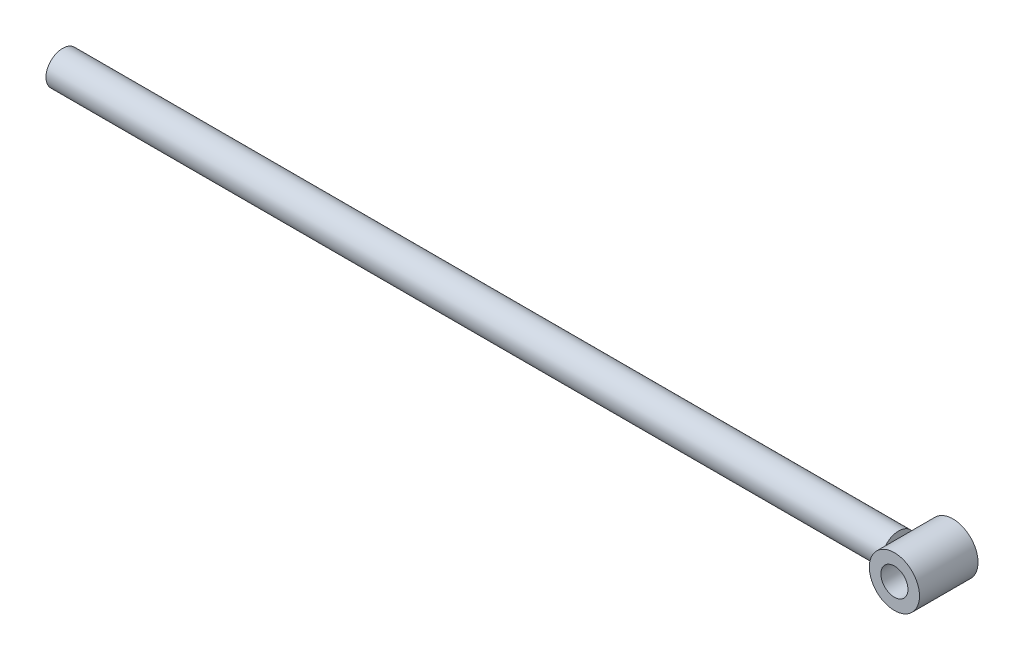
SolidWorks part; units mm, degrees
ref_plane "Plan de face" through (0, 0, 0) normal (0, 0, 1) x (1, 0, 0)
ref_plane "Plan de dessus" through (0, 0, 0) normal (0, 1, 0) x (1, 0, 0)
ref_plane "Plan de droite" through (0, 0, 0) normal (1, 0, 0) x (0, 0, -1)
sketch "Esquisse1" plane through (0, 0, 0) normal (1, 0, 0) x (0, 0, -1)
  circle A0 centre (0, 0) radius 10
  dimension "D1" = 20
extrude "Extrusion1" add sketch "Esquisse1" along normal blind 500
sketch "Esquisse2" plane through (0, 0, 0) normal (0, 0, 1) x (1, 0, 0)
  line L0 (500, -10) -> (500, 10) construction
  circle A0 centre (515, 0) radius 15
  circle A1 centre (515, 0) radius 8.1
  dimension "D1" = 16.2
  dimension "D2" = 30
extrude "Extrusion2" add sketch "Esquisse2" along normal mid plane 35
ref_plane "Plan1" through (487, 0, 0) normal (1, 0, 0) x (0, 0, -1)
